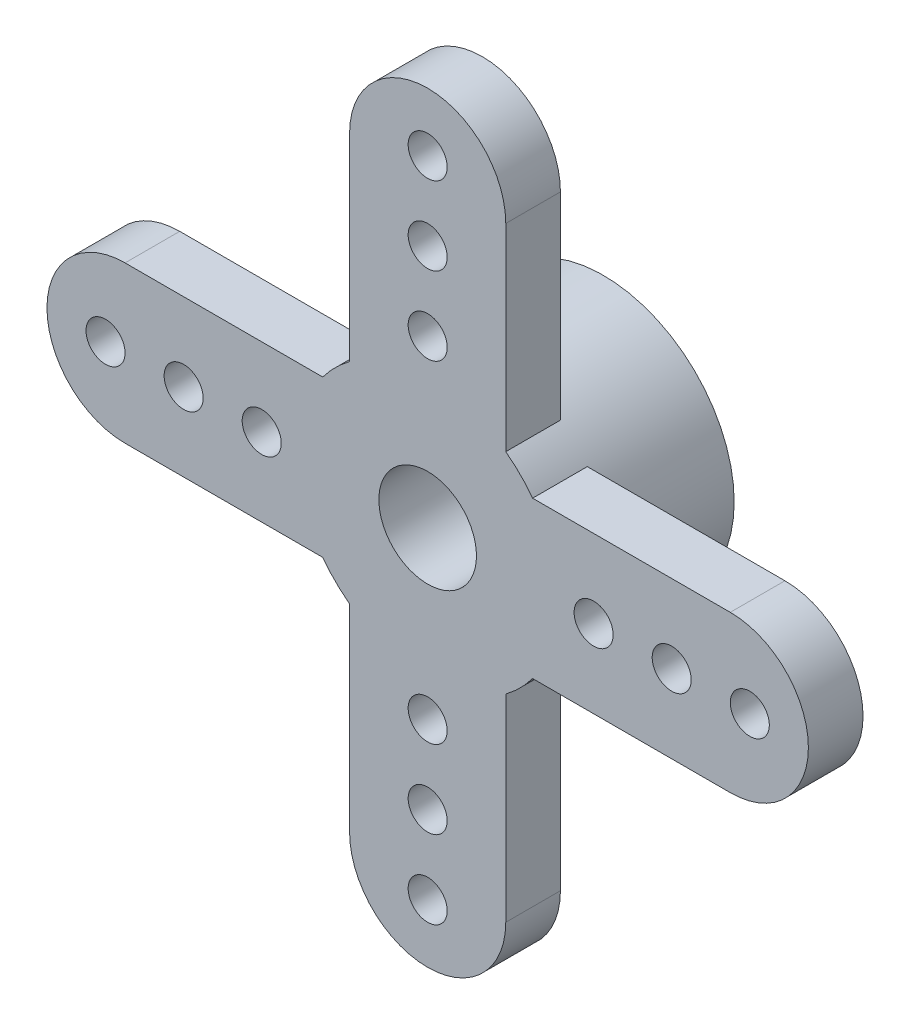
SolidWorks part; units mm, degrees
ref_plane "Ebene vorne" through (0, 0, 0) normal (0, 0, 1) x (1, 0, 0)
ref_plane "Ebene oben" through (0, 0, 0) normal (0, 1, 0) x (1, 0, 0)
ref_plane "Ebene rechts" through (0, 0, 0) normal (1, 0, 0) x (0, 0, -1)
sketch "Skizze1" plane through (0, 0, 0) normal (0, 0, 1) x (1, 0, 0)
  circle A0 centre (0, 0) radius 2.5
  circle A1 centre (0, 0) radius 3.35
extrude "Aufsatz-Linear austragen1" add sketch "Skizze1" along normal blind 4.5
sketch "Skizze2" plane through (0, 0, 4.5) normal (0, 0, 1) x (1, 0, 0)
  circle A0 centre (0, 0) radius 3.35
extrude "Aufsatz-Linear austragen2" add sketch "Skizze2" against normal blind 2
sketch "Skizze3" plane through (0, 0, 4.5) normal (0, 0, 1) x (1, 0, 0)
  circle A0 centre (0, 0) radius 1.25
extrude "Schnitt-Linear austragen1" cut sketch "Skizze3" against normal up to next
sketch "Skizze4" plane through (0, 0, 4.5) normal (0, 0, 1) x (1, 0, 0)
  line L0 (0, 0) -> (0, -50000) construction
  line L1 (0, 0) -> (-50000, 0) construction
  line L2 (0, -7.75) -> (0, 7.75) construction
  line L3 (-2, -7.75) -> (-2, 7.75)
  line L4 (2, -7.75) -> (2, 7.75)
  line L5 (0, -9.75) -> (-6.7501, -9.75) construction
  line L6 (0, -8.25) -> (-6.7501, -8.25) construction
  line L7 (0, -6.25) -> (-6.7501, -6.25) construction
  line L8 (0, -4.25) -> (-6.7501, -4.25) construction
  line L9 (-9.75, 0) -> (-9.75, 6.7501) construction
  line L10 (-8.25, 0) -> (-8.25, 6.7501) construction
  line L11 (-6.25, 0) -> (-6.25, 6.7501) construction
  line L12 (-4.25, 0) -> (-4.25, 6.7501) construction
  line L13 (-7.75, 0) -> (7.75, 0) construction
  line L14 (-7.75, 2) -> (7.75, 2)
  line L15 (-7.75, -2) -> (7.75, -2)
  line L16 (0, 9.75) -> (6.7501, 9.75) construction
  line L17 (0, 8.25) -> (6.7501, 8.25) construction
  line L18 (0, 6.25) -> (6.7501, 6.25) construction
  line L19 (0, 4.25) -> (6.7501, 4.25) construction
  line L20 (0, 7.75) -> (0, -7.75) construction
  line L21 (2, 7.75) -> (2, -7.75)
  line L22 (-2, 7.75) -> (-2, -7.75)
  line L23 (9.75, 0) -> (9.75, -6.7501) construction
  line L24 (8.25, 0) -> (8.25, -6.7501) construction
  line L25 (6.25, 0) -> (6.25, -6.7501) construction
  line L26 (4.25, 0) -> (4.25, -6.7501) construction
  line L27 (7.75, 0) -> (-7.75, 0) construction
  line L28 (7.75, -2) -> (-7.75, -2)
  line L29 (7.75, 2) -> (-7.75, 2)
  arc A0 (-2, -7.75) -> (2, -7.75) centre (0, -7.75) ccw
  arc A1 (2, 7.75) -> (-2, 7.75) centre (0, 7.75) ccw
  circle A2 centre (0, -8.25) radius 0.5
  circle A3 centre (0, -6.25) radius 0.5
  circle A4 centre (0, -4.25) radius 0.5
  circle A5 centre (-8.25, 0) radius 0.5
  circle A6 centre (-6.25, 0) radius 0.5
  circle A7 centre (-4.25, 0) radius 0.5
  arc A8 (-7.75, 2) -> (-7.75, -2) centre (-7.75, 0) ccw
  arc A9 (7.75, -2) -> (7.75, 2) centre (7.75, 0) ccw
  circle A10 centre (0, 8.25) radius 0.5
  circle A11 centre (0, 6.25) radius 0.5
  circle A12 centre (0, 4.25) radius 0.5
  arc A13 (2, 7.75) -> (-2, 7.75) centre (0, 7.75) ccw
  arc A14 (-2, -7.75) -> (2, -7.75) centre (0, -7.75) ccw
  circle A15 centre (8.25, 0) radius 0.5
  circle A16 centre (6.25, 0) radius 0.5
  circle A17 centre (4.25, 0) radius 0.5
  arc A18 (7.75, -2) -> (7.75, 2) centre (7.75, 0) ccw
  arc A19 (-7.75, 2) -> (-7.75, -2) centre (-7.75, 0) ccw
  point P8 (0, 0)
  point P29 (0, 0)
  point P47 (0, 0)
  point P65 (0, 0)
  point P80 (0, 0)
  dimension "D1" = 1.5
  dimension "D4" = 4
  dimension "D2" = 2
  dimension "D3" = 2
extrude "Aufsatz-Linear austragen4" add sketch "Skizze4" against normal blind 1.4 contours L15 A9 L14 L1 A17 A16 A15 | L14 A8 L15 L1 A5 A6 A7 | L3 A0 L4 L1 A4 A3 A2 | L4 A1 L3 L1 A12 A11 A10 | L4 L15 L1 L14 | L15 L3 L1 L4 | L3 L14 L4 L1 | L3 L15 L4 L14 L0 | L1 L15 L3 L14
